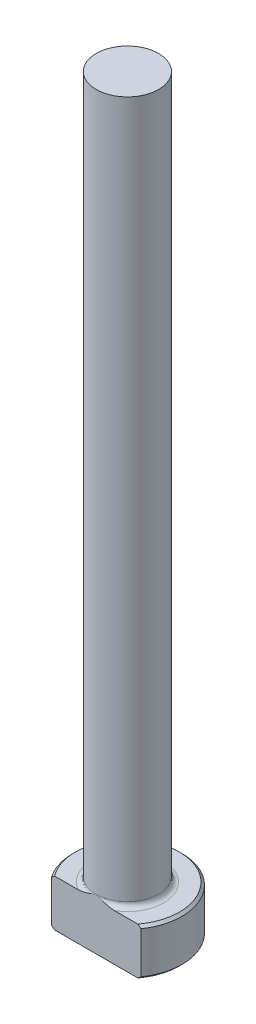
SolidWorks part; units mm, degrees
ref_plane "Front Plane" through (0, 0, 0) normal (0, 0, 1) x (1, 0, 0)
ref_plane "Top Plane" through (0, 0, 0) normal (0, 1, 0) x (1, 0, 0)
ref_plane "Right Plane" through (0, 0, 0) normal (1, 0, 0) x (0, 0, -1)
sketch "Sketch1" plane through (0, 0, 0) normal (0, 0, 1) x (1, 0, 0)
  line L0 (0, 259.9588) -> (0, -15.1925) construction
  line L1 (0, 0) -> (-5.5499, 0)
  line L2 (-5.5499, 0) -> (-5.5499, 4.7498)
  line L3 (-5.5499, 4.7498) -> (-3.175, 4.7498)
  line L4 (-3.175, 4.7498) -> (-3.175, 76.2)
  line L5 (-3.175, 76.2) -> (0, 76.2)
  line L6 (0, 76.2) -> (0, 0)
  dimension "L" = 76.2
  dimension "H" = 11.0998
  dimension "T" = 4.7498
  dimension "D" = 6.35
revolve "Revolve1" add sketch "Sketch1" angle 360 about L0
chamfer "Chamfer1" distance 0.254 angle 45 2 edges at (0, 4.7498, 5.5499) (0, 0, 5.5499)
fillet "Fillet1" radius 0.508 1 edges at (0, 4.7498, 3.175)
sketch "Sketch2" plane through (0, 0, 0) normal (0, -1, 0) x (1, 0, 0)
  line L0 (-4.552, 3.175) -> (4.552, 3.175)
  arc A0 (4.552, 3.175) -> (-4.552, 3.175) centre (0, 0) ccw
  circle A1 centre (0, 0) radius 5.5499 construction
  circle A3 centre (0, 0) radius 3.175 construction
extrude "KEY" cut sketch "Sketch2" against normal through all
sketch "Pocket Sketch" plane through (0, 0, 0) normal (0, 0, 1) x (1, 0, 0)
  line L0 (-5.9468, 0) -> (-5.9468, 4.7752)
  line L1 (-5.9468, 4.7752) -> (-4.3339, 4.7752)
  line L2 (-3.5719, 5.5372) -> (-3.5719, 22.225)
  line L3 (-3.5719, 22.225) -> (0, 22.225)
  line L4 (0, 22.225) -> (0, 0)
  line L5 (0, 0) -> (-5.9468, 0)
  line L6 (0, 12.6104) -> (0, -2.4989) construction
  line L7 (-5.5499, 4.4958) -> (-5.5499, 0.254) construction
  line L8 (5.2959, 4.7498) -> (-5.2959, 4.7498) construction
  line L9 (-3.175, 76.2) -> (-3.175, 5.2578) construction
  line L10 (-4.3339, 4.7752) -> (-3.5719, 5.5372)
  point P3 (-3.5719, 4.7752)
  dimension "D1" = 11.8935
  dimension "D2" = 0.3969
  dimension "D3" = 0.0254
  dimension "D4" = 0.3969
  dimension "D5" = 7.1437
  dimension "D6" = 22.225
